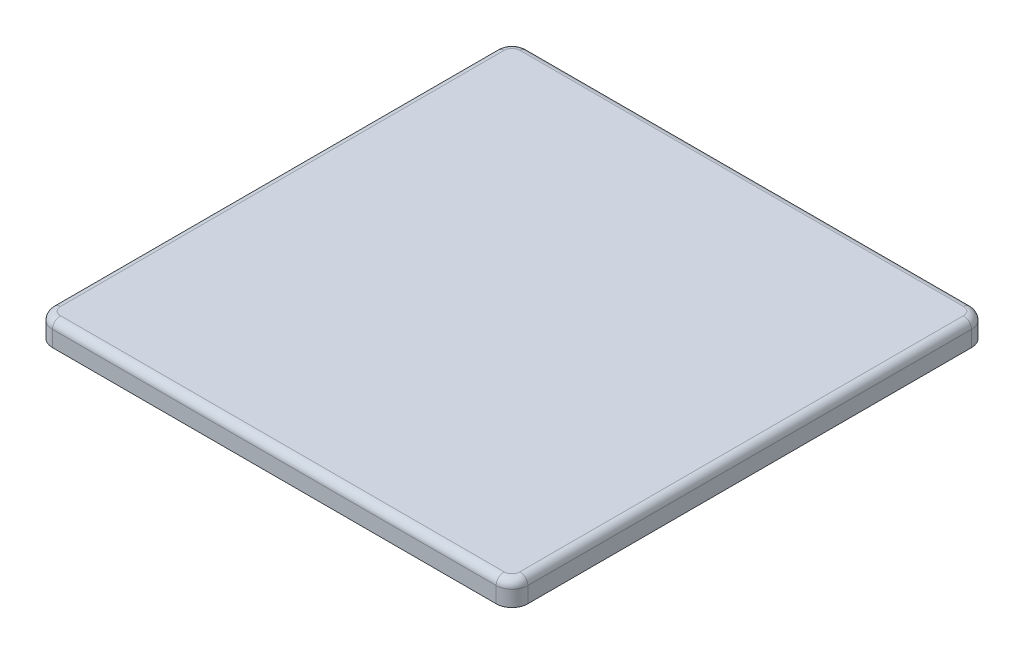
SolidWorks part; units mm, degrees
ref_plane "正面" through (0, 0, 0) normal (0, 0, 1) x (1, 0, 0)
ref_plane "平面" through (0, 0, 0) normal (0, 1, 0) x (1, 0, 0)
ref_plane "右側面" through (0, 0, 0) normal (1, 0, 0) x (0, 0, -1)
sketch "ｽｹｯﾁ1" plane through (0, 0, 0) normal (0, 1, 0) x (0, 0, -1)
  line L1 (-28, 30) -> (28, 30)
  line L2 (-30, 28) -> (-30, -28)
  line L3 (-28, -30) -> (28, -30)
  line L4 (30, 28) -> (30, -28)
  arc A0 (30, 28) -> (28, 30) centre (28, 28) ccw
  arc A1 (28, -30) -> (30, -28) centre (28, -28) ccw
  arc A2 (-30, -28) -> (-28, -30) centre (-28, -28) ccw
  arc A3 (-28, 30) -> (-30, 28) centre (-28, 28) ccw
  point P7 (30, 30)
  point P10 (30, -30)
  point P15 (-30, 30)
  dimension "D5" = 2
  dimension "D1" = 30
  dimension "D2" = 60
  dimension "D3" = 30
  dimension "D4" = 60
extrude "押し出し1" add sketch "ｽｹｯﾁ1" along normal mid plane 3
fillet "ﾌｨﾚｯﾄ1" radius 1 8 edges at (-29.4142, 1.5, 29.4142) (-30, 1.5, 0) (-29.4142, 1.5, -29.4142) (0, 1.5, -30) (29.4142, 1.5, -29.4142) (30, 1.5, 0) (29.4142, 1.5, 29.4142) (0, 1.5, 30)
sketch "ｽｹｯﾁ2" plane through (0, -1.5, 0) normal (0, -1, 0) x (1, 0, 0)
  line L1 (-28, 28.2) -> (28, 28.2)
  line L2 (-28.2, 28) -> (-28.2, -28)
  line L3 (-28, -28.2) -> (28, -28.2)
  line L4 (28.2, 28) -> (28.2, -28)
  arc A0 (-28, 28.2) -> (-28.2, 28) centre (-28, 28) ccw
  arc A1 (28.2, 28) -> (28, 28.2) centre (28, 28) ccw
  arc A2 (28, -28.2) -> (28.2, -28) centre (28, -28) ccw
  arc A3 (-28.2, -28) -> (-28, -28.2) centre (-28, -28) ccw
  point P7 (-28.2, 28.2)
  point P10 (28.2, 28.2)
  point P13 (28.2, -28.2)
  dimension "D5" = 0.2
  dimension "D1" = 28.2
  dimension "D2" = 56.4
  dimension "D3" = 28.2
  dimension "D4" = 56.4
extrude "押し出し2" cut sketch "ｽｹｯﾁ2" against normal blind 1
sketch "ｽｹｯﾁ4" plane through (0, -0.5, 0) normal (0, -1, 0) x (1, 0, 0)
  line L0 (-30, -28) -> (-30, 28) construction
  line L1 (-16.65, 17.45) -> (-13.35, 17.45)
  line L2 (-16.65, 17.45) -> (-16.65, 12.55)
  line L3 (-16.65, 12.55) -> (-13.35, 12.55)
  line L4 (-13.35, 17.45) -> (-13.35, 12.55)
  line L5 (30, 28) -> (30, -28) construction
  line L6 (13.35, 12.55) -> (16.65, 12.55)
  line L7 (13.35, 12.55) -> (13.35, 17.45)
  line L8 (13.35, 17.45) -> (16.65, 17.45)
  line L9 (16.65, 12.55) -> (16.65, 17.45)
  line L10 (-16.65, 17.45) -> (-13.35, 12.55) construction
  line L11 (-16.65, 12.55) -> (-13.35, 17.45) construction
  line L12 (13.35, 17.45) -> (16.65, 12.55) construction
  line L13 (13.35, 12.55) -> (16.65, 17.45) construction
  line L14 (-16.65, -12.55) -> (-13.35, -17.45) construction
  line L15 (-16.65, -12.55) -> (-13.35, -12.55)
  line L16 (-16.65, -12.55) -> (-16.65, -17.45)
  line L17 (-16.65, -17.45) -> (-13.35, -17.45)
  line L18 (-13.35, -12.55) -> (-13.35, -17.45)
  line L19 (13.35, -12.55) -> (16.65, -12.55)
  line L20 (13.35, -12.55) -> (13.35, -17.45)
  line L21 (13.35, -17.45) -> (16.65, -17.45)
  line L22 (16.65, -12.55) -> (16.65, -17.45)
  line L23 (-16.65, -17.45) -> (-13.35, -12.55) construction
  line L24 (13.35, -12.55) -> (16.65, -17.45) construction
  line L25 (13.35, -17.45) -> (16.65, -12.55) construction
  point P21 (15, 15)
  point P22 (15, -15)
  dimension "D1" = 3.3
  dimension "D2" = 4.9
  dimension "D3" = 13.35
  dimension "D4" = 17.45
  dimension "D5" = 3.3
  dimension "D6" = 17.45
  dimension "D7" = 4.9
  dimension "D8" = 13.35
  dimension "D9" = 4.9
  dimension "D10" = 17.45
extrude "押し出し4" add sketch "ｽｹｯﾁ4" along normal blind 8 draft 0.6
fillet "ﾌｨﾚｯﾄ2" radius 0.8 16 edges at (-15, -8.5, 17.3662) (-13.4338, -8.5, 15) (-15, -8.5, 12.6338) (-16.5662, -8.5, 15) (15, -8.5, 17.3662) (16.5662, -8.5, 15) (15, -8.5, 12.6338) (13.4338, -8.5, 15) (15, -8.5, -12.6338) (16.5662, -8.5, -15) (15, -8.5, -17.3662) (13.4338, -8.5, -15) (-15, -8.5, -12.6338) (-13.4338, -8.5, -15) (-15, -8.5, -17.3662) (-16.5662, -8.5, -15)
